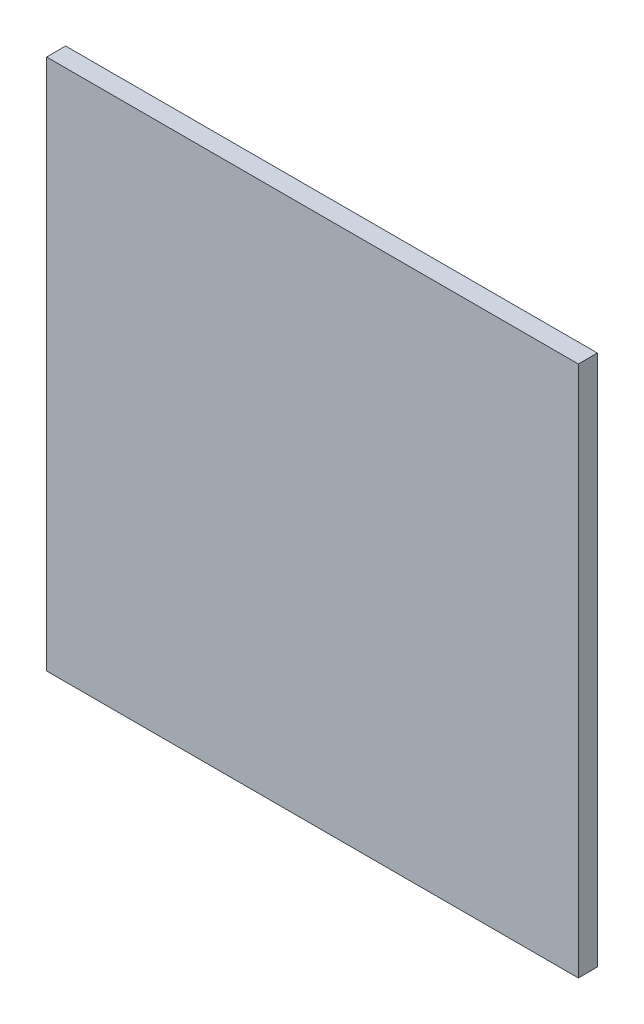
SolidWorks part; units mm, degrees
ref_plane "Front Plane" through (0, 0, 0) normal (0, 0, 1) x (1, 0, 0)
ref_plane "Top Plane" through (0, 0, 0) normal (0, 1, 0) x (1, 0, 0)
ref_plane "Right Plane" through (0, 0, 0) normal (1, 0, 0) x (0, 0, -1)
sketch "Sketch1" plane through (0, 0, 0) normal (0, 0, 1) x (1, 0, 0)
  line L1 (-139.7, 139.7) -> (139.7, 139.7)
  line L2 (-139.7, 139.7) -> (-139.7, -139.7)
  line L3 (-139.7, -139.7) -> (139.7, -139.7)
  line L4 (139.7, 139.7) -> (139.7, -139.7)
  line L5 (-139.7, 139.7) -> (139.7, -139.7) construction
  line L6 (-139.7, -139.7) -> (139.7, 139.7) construction
  point P0 (0, 0)
  dimension "D1" = 279.4
  dimension "D2" = 279.4
extrude "Boss-Extrude1" add sketch "Sketch1" along normal blind 10
sketch "Sketch2" plane through (0, 0, 10) normal (0, 0, 1) x (1, 0, 0)
  line L0 (-139.7, -139.7) -> (139.7, 139.7) construction
  line L1 (-139.7, 139.7) -> (139.7, -139.7) construction
